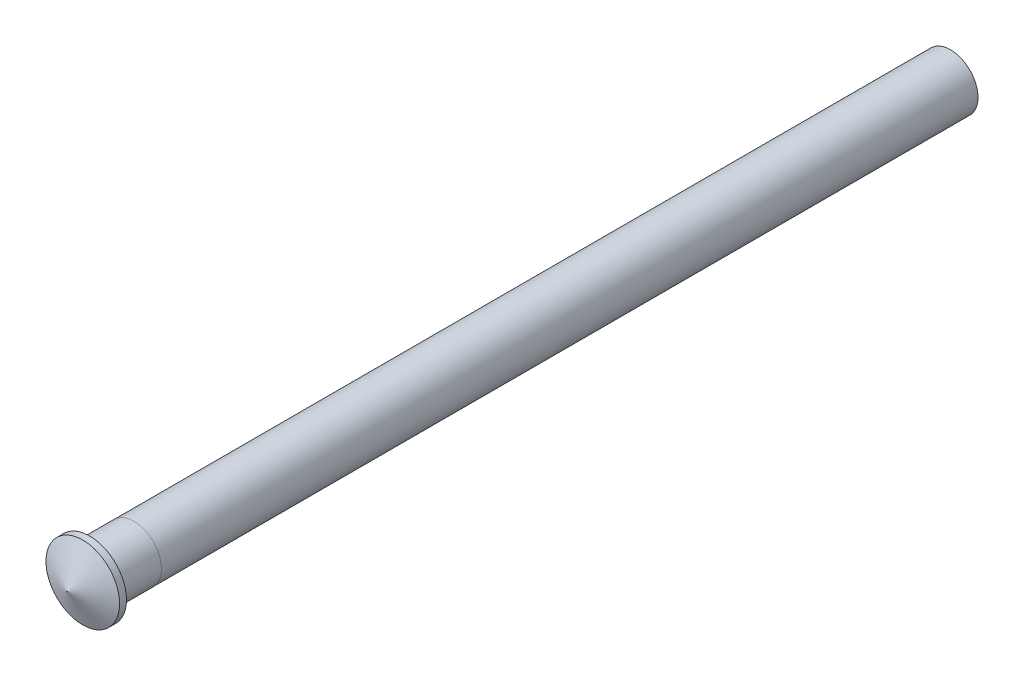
SolidWorks part; units mm, degrees
ref_plane "Front Plane" through (0, 0, 0) normal (0, 0, 1) x (1, 0, 0)
ref_plane "Top Plane" through (0, 0, 0) normal (0, 1, 0) x (1, 0, 0)
ref_plane "Right Plane" through (0, 0, 0) normal (1, 0, 0) x (0, 0, -1)
imported_body "Imported1"
sketch "Sketch1" plane through (0, 0, 0) normal (0, 1, 0) x (1, 0, 0)
  line L0 (4.7625, 7.62) -> (-4.7625, 7.62) construction
  line L1 (-4.7498, 7.62) -> (0, 7.62)
  line L2 (-4.7498, 7.62) -> (-4.7498, 148.5362)
  line L3 (-4.7498, 148.5362) -> (0, 148.5362)
  line L4 (0, 7.62) -> (0, 148.5362)
  line L5 (-4.7498, 54.8132) -> (-4.7498, 7.62) construction
  dimension "D1" = 152.4
revolve "Revolve1" add sketch "Sketch1" angle 360 about L4
